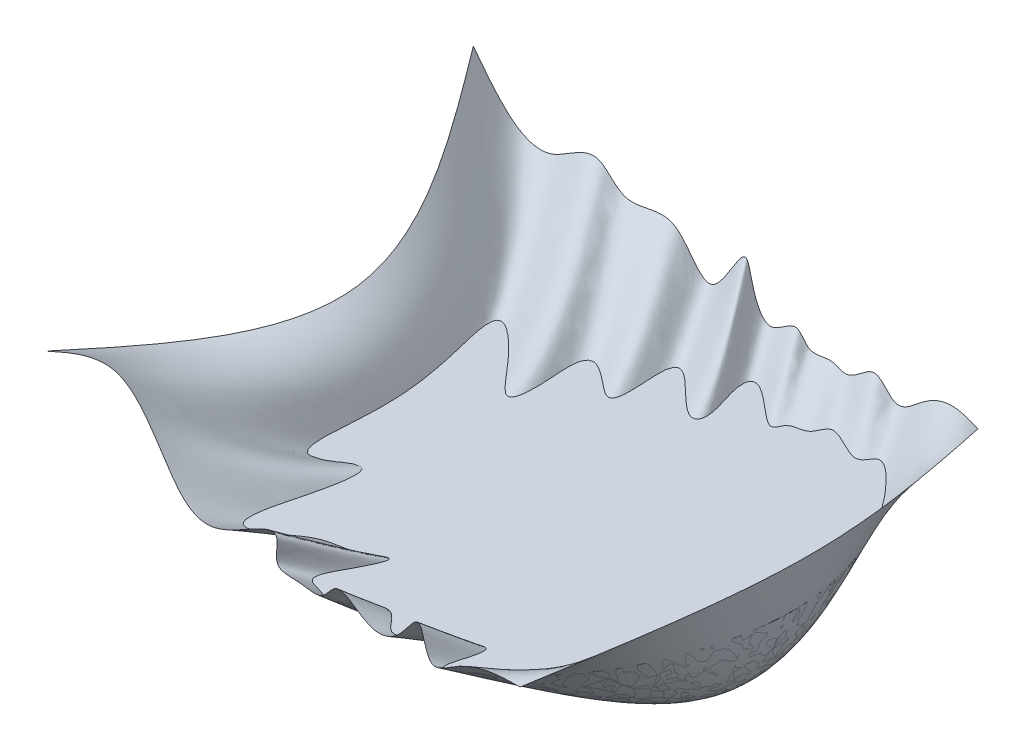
SolidWorks part; units mm, degrees
ref_plane "Vorne" through (0, 0, 0) normal (0, 0, 1) x (1, 0, 0)
ref_plane "Oben" through (0, 0, 0) normal (0, 1, 0) x (1, 0, 0)
ref_plane "Rechts" through (0, 0, 0) normal (1, 0, 0) x (0, 0, -1)
sketch "Skizze1" plane through (0, 0, 0) normal (0, 0, 1) x (1, 0, 0)
  spline S0 degree 3 poles (-139.8019, 42.3939) (-125.9997, 32.6455) (-101.4635, 15.3158) (-96.6934, -55.7527) (-45.2377, 6.76) (-31.0314, -67.6142) (-0.0285, -17.7555) (19.5496, -65.3665) (57.2705, -13.6082) (70.4786, -142.8044) (102.6311, -21.2657) (172.3734, -114.4169) (195.0594, -29.7839) (212.0545, 33.6184) knots 0 0 0 0 0.096801 0.172084 0.249358 0.322436 0.372397 0.429018 0.473571 0.588789 0.694733 0.771311 1 1 1 1
ref_plane "Ebene1" through (0, 0, -171.0979) normal (0, 0, 1) x (1, 0, 0)
sketch "Skizze2" plane through (0, 0, -171.0979) normal (0, 0, 1) x (1, 0, 0)
  point P0 (-216.3653, 84.0379)
  point P1 (-154.1759, 41.677)
  point P2 (-118.124, 56.0977)
  point P3 (-98.2955, 41.677)
  point P4 (-59.5398, 41.677)
  point P5 (-29.2403, 15.4435)
  point P6 (-2.012, 47.0847)
  point P7 (4.4523, 27.2562)
  point P8 (18.3184, 10.1491)
  point P9 (38.5548, 19.0247)
  point P10 (47.7854, 10.1491)
  point P11 (65.8916, 10.1491)
  point P12 (75.8323, 7.3089)
  point P13 (100.329, 19.0247)
  point P14 (115.24, 7.3089)
  point P15 (137.9616, 19.0247)
  point P16 (161.7482, 27.2562)
  point P17 (180.5645, 21.8649)
ref_plane "Ebene2" through (0, 0, 174.9361) normal (0, 0, 1) x (1, 0, 0)
sketch "Skizze3" plane through (0, 0, 174.9361) normal (0, 0, 1) x (1, 0, 0)
  spline S0 degree 3 poles (-206.503, 54.2882) (-186.4794, 63.3215) (-147.0348, 81.1161) (-115.5412, 30.1328) (-80.8954, -20.1735) (-17.2301, 38.9159) (-28.8053, -5.0947) (-5.9631, -2.2492) (11.2951, -8.3834) (21.3298, 12.5106) (38.6903, -0.5646) (54.0756, -9.3735) (72.705, -2.6003) (89.3958, 29.3151) (92.4797, -16.5823) (127.294, 11.1814) (149.8231, 11.6143) (166.4323, 11.9334) knots 0 0 0 0 0.126847 0.249876 0.351849 0.470448 0.506925 0.546529 0.585056 0.618562 0.65868 0.695979 0.736427 0.785449 0.840597 0.882482 1 1 1 1
surface "Oberfläche-Ausformung1"
ref_plane "Ebene3" through (0, -10, 0) normal (0, 1, 0) x (-1, 0, 0)
sketch "Skizze4" plane through (0, -10, 0) normal (0, 1, 0) x (-1, 0, 0)
  spline S0 degree 3 number of poles 936 (100.9766, 21.8453) -> (100.9766, 21.8453)
  spline S1 degree 3 number of poles 936 (100.9766, 21.8453) -> (100.9766, 21.8453)
  point P0 (-663.6387, -301.1849)
extrude "Linear austragen2" add sketch "Skizze4" against normal up to surface
